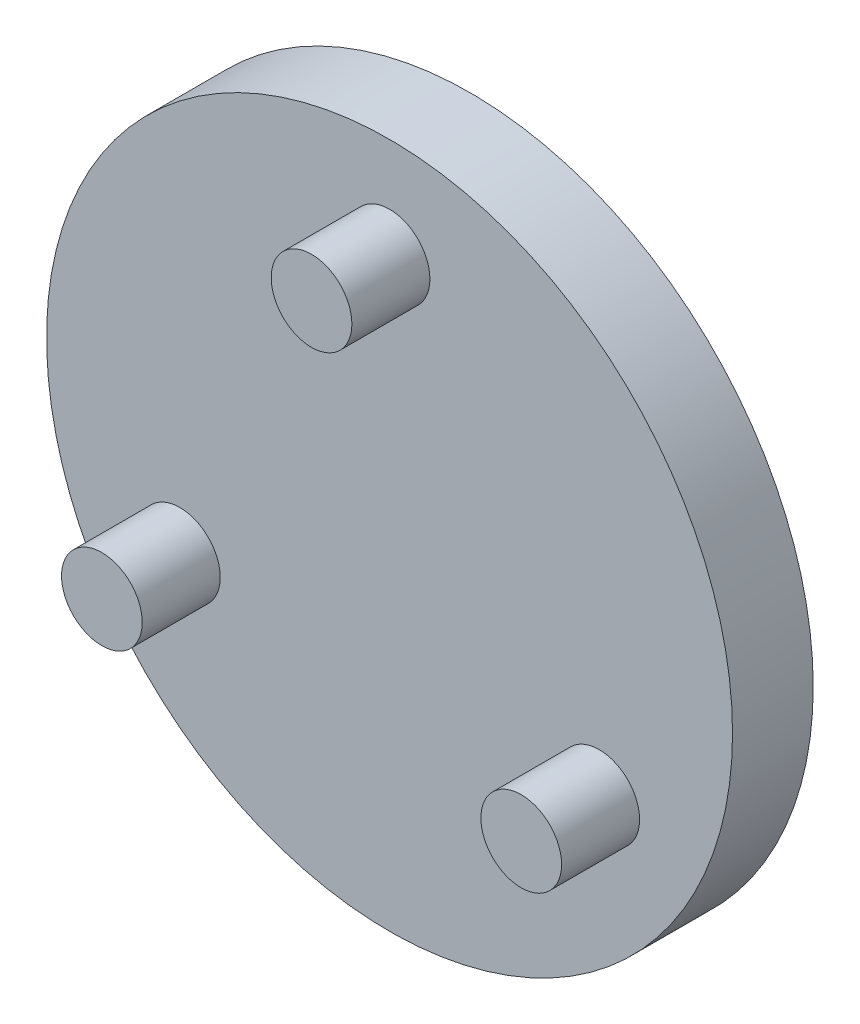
SolidWorks part; units mm, degrees
ref_plane "Plan de face" through (0, 0, 0) normal (0, 0, 1) x (1, 0, 0)
ref_plane "Plan de dessus" through (0, 0, 0) normal (0, 1, 0) x (1, 0, 0)
ref_plane "Plan de droite" through (0, 0, 0) normal (1, 0, 0) x (0, 0, -1)
sketch "Esquisse1" plane through (0, 0, 0) normal (0, 0, 1) x (1, 0, 0)
  circle A0 centre (0, 0) radius 12.75
  dimension "D1" = 25.5
extrude "Extrusion1" add sketch "Esquisse1" along normal blind 3
sketch "Esquisse2" plane through (0, 0, 3) normal (0, 0, 1) x (1, 0, 0)
  line L0 (0, 0) -> (0, 13.853) construction
  circle A0 centre (0, 9) radius 1.5
  circle A1 centre (0, 0) radius 9 construction
  circle A2 centre (7.7942, -4.5) radius 1.5
  circle A3 centre (-7.7942, -4.5) radius 1.5
  dimension "D1" = 3
  dimension "D2" = 18
extrude "Extrusion2" add sketch "Esquisse2" along normal blind 2.9
sketch "Esquisse3" plane through (0, 0, 0) normal (0, 0, -1) x (-1, 0, 0)
  circle A0 centre (0, 0) radius 1.5
  dimension "D1" = 3
extrude "Extrusion3" add sketch "Esquisse3" along normal blind 2.9
